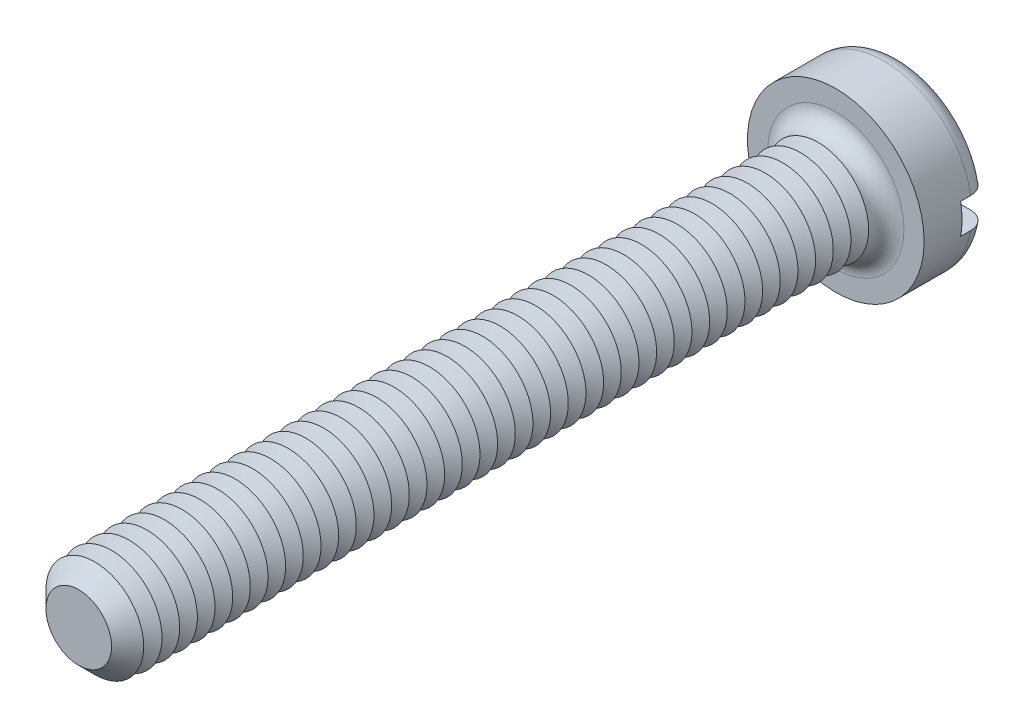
SolidWorks part; units mm, degrees
ref_plane "Front Plane" through (0, 0, 0) normal (0, 0, 1) x (1, 0, 0)
ref_plane "Top Plane" through (0, 0, 0) normal (0, 1, 0) x (1, 0, 0)
ref_plane "Right Plane" through (0, 0, 0) normal (1, 0, 0) x (0, 0, -1)
sketch "Sketch3" plane through (0, 0, 0) normal (0, 0, 1) x (1, 0, 0)
  circle A0 centre (0, 0) radius 3.5
  dimension "D1" = 7
extrude "Boss-Extrude2" add sketch "Sketch3" against normal blind 2.6
sketch "Sketch4" plane through (0, 0, 0) normal (0, 0, 1) x (1, 0, 0)
  circle A0 centre (0, 0) radius 2
  dimension "D1" = 4
extrude "Boss-Extrude3" add sketch "Sketch4" along normal blind 30
fillet "Fillet1" radius 0.7 2 edges at (3.5, 0, -2.6) (2, 0, 0)
chamfer "Chamfer1" distance 0.7 angle 45 1 edges at (2, 0, 30)
sketch "Sketch5" plane through (0, 0, 0) normal (1, 0, 0) x (0, 0, -1)
  line L0 (1.6944, 0) -> (-7.6738, 0) construction
sketch "Sketch6" plane through (0, 0, 0) normal (1, 0, 0) x (0, 0, -1)
  line L0 (-0.7, 2) -> (-1.05, 1.3938)
  line L1 (-1.05, 1.3938) -> (-1.4, 2)
  line L2 (-0.7, 2) -> (-29.3, 2) construction
  line L3 (-1.4, 2) -> (-0.7, 2)
  dimension "D1" = 0.7
revolve "Cut-Revolve1" cut sketch "Sketch6" angle 360 about L0
pattern_linear "LPattern1" count 41 spacing 0.7 along (0, 0, 1) of "Cut-Revolve1"
sketch "Sketch8" plane through (0, 0, -2.6) normal (0, 0, -1) x (-1, 0, 0)
  line L1 (3.5, -0.6) -> (-3.5, -0.6)
  line L2 (3.5, -0.6) -> (3.5, 0.6)
  line L3 (3.5, 0.6) -> (-3.5, 0.6)
  line L4 (-3.5, -0.6) -> (-3.5, 0.6)
  line L5 (3.5, -0.6) -> (-3.5, 0.6) construction
  line L6 (3.5, 0.6) -> (-3.5, -0.6) construction
  point P0 (0, 0)
  dimension "D1" = 7
  dimension "D2" = 1.2
extrude "Cut-Extrude1" cut sketch "Sketch8" against normal blind 1.1
